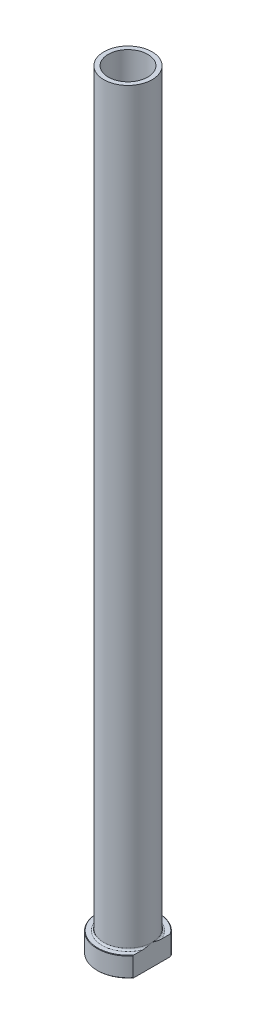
SolidWorks part; units mm, degrees
ref_plane "Front Plane" through (0, 0, 0) normal (0, 0, 1) x (1, 0, 0)
ref_plane "Top Plane" through (0, 0, 0) normal (0, 1, 0) x (1, 0, 0)
ref_plane "Right Plane" through (0, 0, 0) normal (1, 0, 0) x (0, 0, -1)
sketch "Sketch1" plane through (0, 0, 0) normal (0, 0, 1) x (1, 0, 0)
  line L0 (-9, 350) -> (-11, 350)
  line L1 (-11, 350) -> (-11, 9)
  line L2 (-11, 9) -> (-14, 9)
  line L3 (-14, 9) -> (-14, 0)
  line L4 (13.75, 0) -> (-13.75, 0) construction
  line L5 (-14, 0) -> (-9.25, 0)
  line L6 (-9, 295) -> (-9, 350)
  line L7 (0, 92.1877) -> (0, -15.5353) construction
  line L8 (0, -15.4) -> (0, 15.4) construction
  line L9 (-9, 295) -> (-9.25, 283)
  line L10 (-9.25, 283) -> (-9.25, 0)
  dimension "D1" = 0.25
  dimension "ID" = 18
  dimension "OD" = 22
  dimension "L" = 350
  dimension "H" = 28
  dimension "T" = 9
  dimension "N" = 55
  dimension "D2" = 12
  dimension "L-N" = 295
revolve "Revolve1" add sketch "Sketch1" angle 360 about L7
fillet "Fillet1" radius 0.8 1 edges at (0, 9, 11)
chamfer "Chamfer1" distance 0.2 angle 45 2 edges at (0, 9, 14) (0, 0, 14)
sketch "Sketch2" plane through (0, 0, 0) normal (0, -1, 0) x (1, 0, 0)
  line L0 (11, 8.6603) -> (11, -8.6603)
  circle A0 centre (0, 0) radius 14 construction
  arc A1 (11, 8.6603) -> (11, -8.6603) centre (0, 0) cw
  circle A2 centre (0, 0) radius 11 construction
extrude "Cut-Extrude1" cut sketch "Sketch2" against normal through all
chamfer "Chamfer2" distance 0.5 angle 45 1 edges at (0, 0, 9.25)
